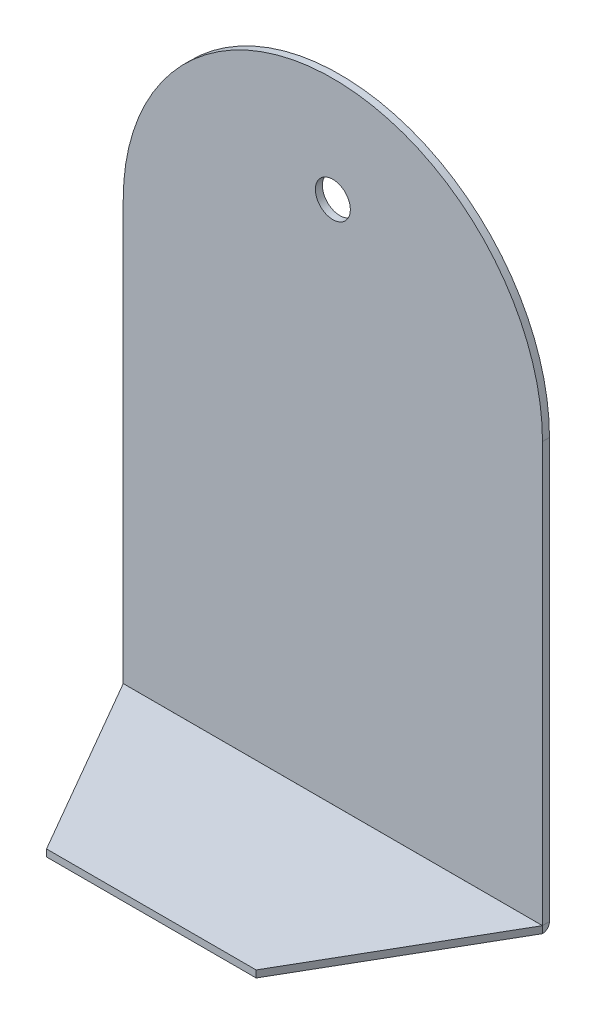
SolidWorks part; units mm, degrees
ref_plane "Front Plane" through (0, 0, 0) normal (0, 0, 1) x (1, 0, 0)
ref_plane "Top Plane" through (0, 0, 0) normal (0, 1, 0) x (1, 0, 0)
ref_plane "Right Plane" through (0, 0, 0) normal (1, 0, 0) x (0, 0, -1)
sketch "Sketch1" plane through (0, 0, 0) normal (0, 0, 1) x (1, 0, 0)
  line L0 (0, 0) -> (0, 30) construction
  line L1 (30, 0) -> (-30, 0) construction
  line L2 (30, 0) -> (30, -60)
  line L3 (30, -60) -> (15, -85.9808)
  line L4 (15, -85.9808) -> (-15, -85.9808)
  line L5 (-15, -85.9808) -> (-30, -60)
  line L6 (-30, -60) -> (-30, 0)
  line L7 (30, -60) -> (-30, -60) construction
  arc A0 (30, 0) -> (-30, 0) centre (0, 0) ccw
  circle A1 centre (0, 15) radius 2.5
  circle A2 centre (0, -60) radius 30 construction
  dimension "D1" = 30
  dimension "D2" = 5
  dimension "D3" = 15
  dimension "D7" = 60
  dimension "D4" = 60
  dimension "D5" = 60
  dimension "D6" = 60
sheet metal parameters "Sheet-Metal1" thickness 1 parameters "D1"=1
base flange "Base-Flange1" sketch "Sketch1" thickness 1 reverse thickness direction yes parameters "D1"=1
sketch "Sketch3" plane through (0, 0, 1) normal (0, 0, 1) x (1, 0, 0)
  line L0 (-30, -60) -> (30, -60)
sketched bend "Sketched Bend1" parameters "D1"=0.001
bend "SketchBend1" bend radius 0.001 bend angle 90 parameters "D5"=1
flat pattern "Flat-Pattern1"
sketch "Bend-Lines1" plane through (0, 0, 0) normal (0, 1, 0) x (-1, 0, 0)
bend of the flat pattern "Flatten-<SketchBend1>1"
